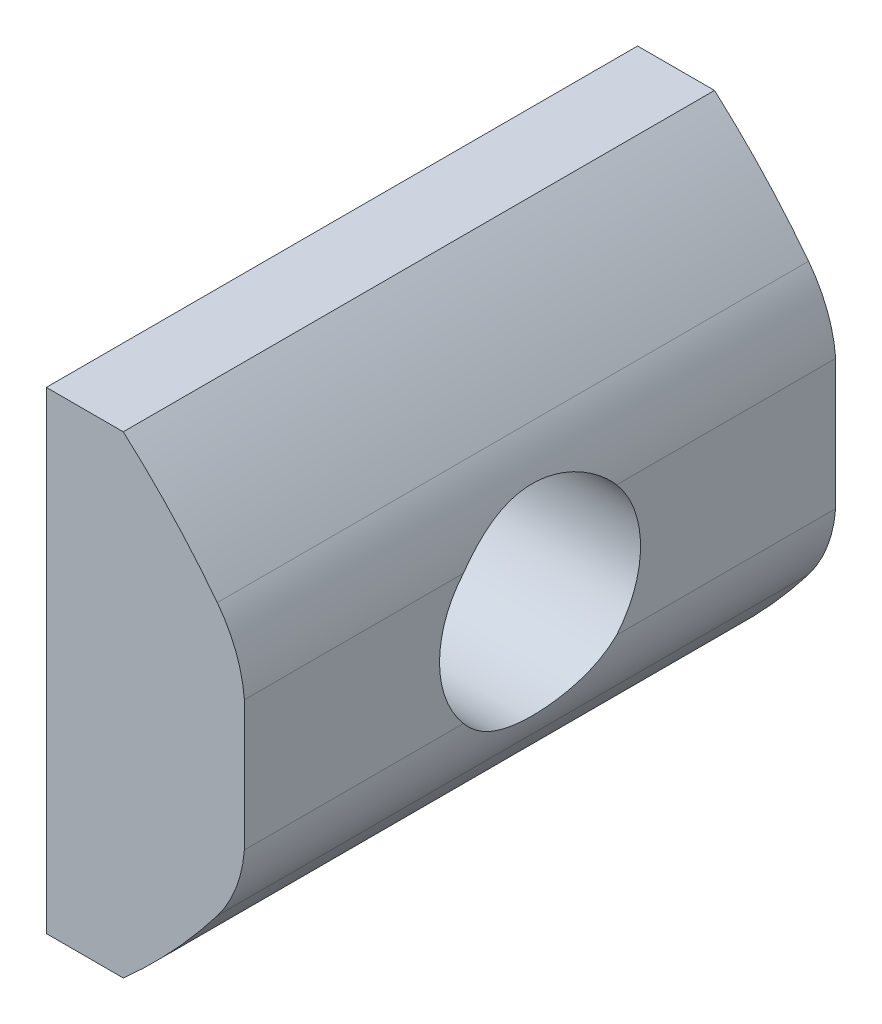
SolidWorks part; units mm, degrees
ref_plane "Face" through (0, 0, 0) normal (0, 0, 1) x (1, 0, 0)
ref_plane "Dessus" through (0, 0, 0) normal (0, 1, 0) x (1, 0, 0)
ref_plane "Droite" through (0, 0, 0) normal (1, 0, 0) x (0, 0, -1)
sketch "Esquisse1" plane through (0, 0, 0) normal (0, 0, 1) x (1, 0, 0)
  line L0 (4, 2.2) -> (4, -2.2)
  line L1 (-3, 8) -> (-3, -8)
  line L2 (-3, 8) -> (-0.0973, 8)
  line L3 (-13.2281, 0) -> (13.0623, 0) construction
  line L4 (-3, -8) -> (-0.0973, -8)
  arc A0 (3.0833, -4.5866) -> (-0.0973, -8) centre (-16.35, 10.3331) cw
  arc A1 (4, -2.2) -> (3.0833, -4.5866) centre (-0.4861, -1.8463) cw
  arc A2 (4, 2.2) -> (3.0833, 4.5866) centre (-0.4861, 1.8463) ccw
  arc A3 (3.0833, 4.5866) -> (-0.0973, 8) centre (-16.35, -10.3331) ccw
  point P6 (4, 0)
  point P14 (-3, 0)
  dimension "D2" = 4.5
  dimension "D3" = 8
  dimension "D1" = 4
  dimension "D6" = 7
  dimension "D8" = 2.2
extrude "Extrusion1" add sketch "Esquisse1" along normal mid plane 20
chamfer "Chanfrein1" distance 0.3 angle 45
hole_wizard "Trou taraudé M8x1.252" positions "Esquisse5" profile "Esquisse4" tap size "M8x1.25" standard "ISO"
sketch "Esquisse5" plane through (-3, 0, 0) normal (-1, 0, 0) x (0, 0, 1)
  point P0 (0, 0)
sketch "Esquisse4" plane through (-3, 0, 0) normal (0, 1, 0) x (0, 0, 1)
  line L0 (0, 0) -> (0, 7)
  line L1 (0, 7) -> (3.4, 7)
  line L2 (3.4, 7) -> (3.4, 0)
  line L5 (3.4, 0) -> (0, 0)
  line L11 (0, -6.35) -> (0, 107.95) construction
  dimension "Diamètre du trou pour taraudage jusqu'au prochain" = 6.8
  dimension "Profondeur du trou pour taraudage jusqu'au prochain" = 7
